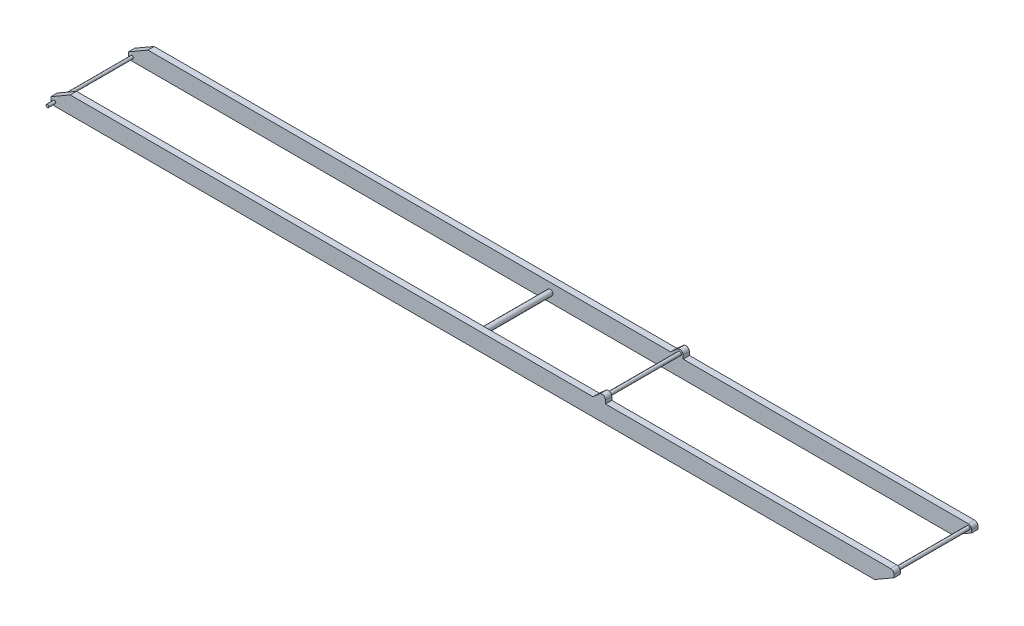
SolidWorks part; units mm, degrees
ref_plane "Face" through (0, 0, 0) normal (0, 0, 1) x (1, 0, 0)
ref_plane "Dessus" through (0, 0, 0) normal (0, 1, 0) x (1, 0, 0)
ref_plane "Droite" through (0, 0, 0) normal (1, 0, 0) x (0, 0, -1)
sketch "Esquisse1" plane through (0, 0, 0) normal (0, 0, 1) x (1, 0, 0)
  line L0 (50, 0) -> (50, -40)
  line L1 (0, 50) -> (-11722.8719, 50)
  line L2 (50, -40) -> (-227.1281, -200)
  line L3 (-227.1281, -200) -> (-11950, -200)
  line L4 (-12000, -110) -> (-12000, -150)
  line L5 (-12000, -110) -> (-11722.8719, 50)
  circle A0 centre (0, 0) radius 25
  arc A1 (-11950, -200) -> (-12000, -150) centre (-11950, -150) cw
  circle A2 centre (-11949.0585, -150) radius 20
  arc A3 (50, 0) -> (0, 50) centre (0, 0) ccw
  dimension "D1" = 50
  dimension "D2" = 250
  dimension "D4" = 40
  dimension "D8" = 50
  dimension "D3" = 12000
  dimension "D5" = 11950
  dimension "D6" = 200
  dimension "D7" = 50
  dimension "D9" = 30
  dimension "D10" = 40
  dimension "D11" = 30
  dimension "D12" = 40
extrude "Extrusion1" add sketch "Esquisse1" along normal mid plane 1200
sketch "Esquisse2" plane through (0, 50, 0) normal (0, 1, 0) x (1, 0, 0)
  line L0 (0, 600) -> (-11722.8719, 600) construction
  line L1 (-12390.7178, 510) -> (211.9968, 510)
  line L2 (-12390.7178, 510) -> (-12390.7178, -510)
  line L3 (-12390.7178, -510) -> (211.9968, -510)
  line L4 (211.9968, 510) -> (211.9968, -510)
  dimension "D1" = 1020
  dimension "D2" = 90
extrude "Enlèv. mat.-Extru.1" cut sketch "Esquisse2" against normal through all
sketch "Esquisse3" plane through (0, 0, 0) normal (0, 0, 1) x (1, 0, 0)
  circle A0 centre (-11949.0585, -150) radius 20
  circle A1 centre (-11949.0585, -150) radius 20 construction
extrude "Extrusion2" add sketch "Esquisse3" along normal mid plane 1400
sketch "Esquisse4" plane through (0, 0, 0) normal (0, 0, 1) x (1, 0, 0)
  circle A0 centre (0, 0) radius 25 construction
  circle A1 centre (0, 0) radius 25
extrude "Extrusion3" add sketch "Esquisse4" along normal mid plane 1200
sketch "Esquisse5" plane through (0, 0, 0) normal (0, 0, 1) x (1, 0, 0)
  line L0 (0, 50) -> (-11722.8719, 50) construction
  circle A0 centre (-5974.5293, -75) radius 40
  dimension "D1" = 80
  dimension "D2" = 5975
  dimension "D3" = 125
extrude "Extrusion4" add sketch "Esquisse5" along normal mid plane 1200
sketch "Esquisse6" plane through (0, 0, 0) normal (0, 0, 1) x (1, 0, 0)
  line L0 (0, 50) -> (-11722.8719, 50) construction
  circle A0 centre (-4123.8594, 97) radius 25
  dimension "D3" = 50
  dimension "D1" = 4125
  dimension "D2" = 47
extrude "Extrusion5" add sketch "Esquisse6" along normal mid plane 1200
sketch "Esquisse7" plane through (0, 0, 600) normal (0, 0, 1) x (1, 0, 0)
  line L0 (-4073.8594, 97) -> (-4073.8594, 47)
  line L1 (-4073.8594, 47) -> (-4255.624, 47)
  line L2 (-4255.624, 47) -> (-4157.0295, 134.4131)
  arc A0 (-4073.8594, 97) -> (-4157.0295, 134.4131) centre (-4123.8594, 97) ccw
  circle A1 centre (-4123.8594, 97) radius 25 construction
  dimension "D1" = 100
extrude "Extrusion6" add sketch "Esquisse7" against normal up to surface (90 mm away)
sketch "Esquisse8" plane through (0, 0, -600) normal (0, 0, -1) x (-1, 0, 0)
  line L8 (12000, -150) -> (12000, -110)
  line L9 (12000, -150) -> (12000, -110)
  line L10 (4073.8594, 50) -> (0, 50)
  line L11 (-50, 0) -> (-50, -40)
  line L12 (-50, -40) -> (227.1281, -200)
  line L13 (227.1281, -200) -> (11950, -200)
  line L15 (4073.8594, 97) -> (4073.8594, 50)
  line L16 (4073.8594, 97) -> (4073.8594, 50)
  line L17 (11722.8719, 50) -> (4252.2403, 50)
  line L18 (11722.8719, 50) -> (4252.2403, 50)
  line L19 (4073.8594, 50) -> (0, 50)
  line L20 (-50, 0) -> (-50, -40)
  line L21 (-50, -40) -> (227.1281, -200)
  line L22 (227.1281, -200) -> (11950, -200)
  line L23 (12000, -110) -> (11722.8719, 50)
  line L24 (12000, -110) -> (11722.8719, 50)
  line L25 (4252.2403, 50) -> (4157.0295, 134.4131)
  line L26 (4252.2403, 50) -> (4157.0295, 134.4131)
  arc A3 (0, 50) -> (-50, 0) centre (0, 0) ccw
  arc A4 (11950, -200) -> (12000, -150) centre (11950, -150) ccw
  arc A5 (4157.0295, 134.4131) -> (4073.8594, 97) centre (4123.8594, 97) ccw
  arc A6 (0, 50) -> (-50, 0) centre (0, 0) ccw
  arc A7 (11950, -200) -> (12000, -150) centre (11950, -150) ccw
  arc A8 (4157.0295, 134.4131) -> (4073.8594, 97) centre (4123.8594, 97) ccw
  dimension "D1" = 0
extrude "Extrusion7" add sketch "Esquisse8" against normal up to surface (90 mm away)
